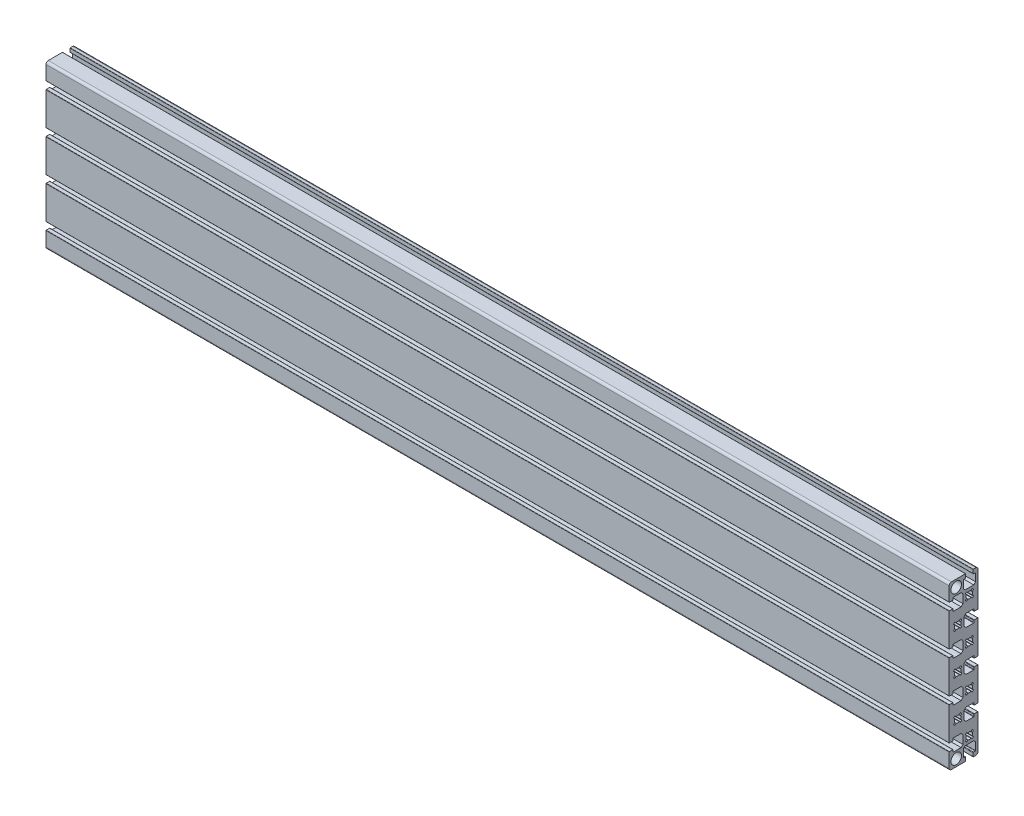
SolidWorks part; units mm, degrees
ref_plane "Front Plane" through (0, 0, 0) normal (0, 0, 1) x (1, 0, 0)
ref_plane "Top Plane" through (0, 0, 0) normal (0, 1, 0) x (1, 0, 0)
ref_plane "Right Plane" through (0, 0, 0) normal (1, 0, 0) x (0, 0, -1)
sketch "Sketch1" plane through (0, 0, 0) normal (0, 0, 1) x (1, 0, 0)
  line L0 (0, 0) -> (1000, 0)
  dimension "D1" = 1000
other "45-sarja 1.0051 32X180(1)"
ref_plane "Plane1" through (0, 0, 0) normal (1, 0, 0) x (0, 0, -1)
sketch "Model11" plane through (0, 0, 0) normal (1, 0, 0) x (0, 0, -1)
  line L0 (10.4902, 71.3785) -> (9.5003, 72.3684)
  line L1 (9.076, 72.3684) -> (8.0552, 71.3477)
  line L2 (4.1571, 71.3477) -> (3.1363, 72.3684)
  line L3 (2.712, 72.3684) -> (1.7221, 71.3785)
  line L4 (1.7221, 70.9542) -> (2.7429, 69.9335)
  line L5 (2.7429, 66.0353) -> (1.7221, 65.0145)
  line L6 (1.7221, 64.5903) -> (2.712, 63.6003)
  line L7 (3.1363, 63.6003) -> (4.1571, 64.6211)
  line L8 (8.0552, 64.6211) -> (9.076, 63.6003)
  line L9 (9.5003, 63.6003) -> (10.4902, 64.5903)
  line L10 (10.4902, 65.0145) -> (9.4694, 66.0353)
  line L11 (9.4694, 69.9335) -> (10.4902, 70.9542)
  line L12 (15.6061, 49.8844) -> (15.6061, 87.9844)
  line L13 (11.6061, 49.5844) -> (15.3061, 49.5844)
  line L14 (11.1061, 51.9844) -> (11.1061, 50.0844)
  line L15 (2.3061, 52.2844) -> (10.8061, 52.2844)
  line L16 (0.3061, 50.2844) -> (2.3061, 52.2844)
  line L17 (0.3061, 40.6844) -> (0.3061, 50.2844)
  line L18 (2.3061, 38.6844) -> (0.3061, 40.6844)
  line L19 (10.8061, 38.6844) -> (2.3061, 38.6844)
  line L20 (11.1061, 40.8844) -> (11.1061, 38.9844)
  line L21 (15.3061, 41.3844) -> (11.6061, 41.3844)
  line L22 (15.6061, 4.8844) -> (15.6061, 41.0844)
  line L23 (11.6061, 4.5844) -> (15.3061, 4.5844)
  line L24 (11.1061, 6.9844) -> (11.1061, 5.0844)
  line L25 (2.3061, 7.2844) -> (10.8061, 7.2844)
  line L26 (0.3061, 5.2844) -> (2.3061, 7.2844)
  line L27 (0.3061, -4.3156) -> (0.3061, 5.2844)
  line L28 (2.3061, -6.3156) -> (0.3061, -4.3156)
  line L29 (10.8061, -6.3156) -> (2.3061, -6.3156)
  line L30 (11.1061, -4.1156) -> (11.1061, -6.0156)
  line L31 (15.3061, -3.6156) -> (11.6061, -3.6156)
  line L32 (15.6061, -40.1156) -> (15.6061, -3.9156)
  line L33 (11.6061, -40.4156) -> (15.3061, -40.4156)
  line L34 (11.1061, -38.0156) -> (11.1061, -39.9156)
  line L35 (2.3061, -37.7156) -> (10.8061, -37.7156)
  line L36 (0.3061, -39.7156) -> (2.3061, -37.7156)
  line L37 (0.3061, -49.3156) -> (0.3061, -39.7156)
  line L38 (2.3061, -51.3156) -> (0.3061, -49.3156)
  line L39 (10.8061, -51.3156) -> (2.3061, -51.3156)
  line L40 (11.1061, -49.1156) -> (11.1061, -51.0156)
  line L41 (15.3061, -48.6156) -> (11.6061, -48.6156)
  line L42 (15.6061, -87.0156) -> (15.6061, -48.9156)
  line L43 (10.5061, -89.5156) -> (13.1061, -89.5156)
  line L44 (10.2061, -85.5156) -> (10.2061, -89.2156)
  line L45 (12.6061, -85.0156) -> (10.7061, -85.0156)
  line L46 (12.9061, -76.2156) -> (12.9061, -84.7156)
  line L47 (10.9061, -74.2156) -> (12.9061, -76.2156)
  line L48 (1.3061, -74.2156) -> (10.9061, -74.2156)
  line L49 (-0.6939, -76.2156) -> (1.3061, -74.2156)
  line L50 (-0.6939, -84.7156) -> (-0.6939, -76.2156)
  line L51 (1.5061, -85.0156) -> (-0.3939, -85.0156)
  line L52 (2.0061, -89.2156) -> (2.0061, -85.5156)
  line L53 (-13.8939, -89.5156) -> (1.7061, -89.5156)
  line L54 (-16.3939, -71.4156) -> (-16.3939, -87.0156)
  line L55 (-12.3939, -71.1156) -> (-16.0939, -71.1156)
  line L56 (-11.8939, -73.5156) -> (-11.8939, -71.6156)
  line L57 (-3.0939, -73.8156) -> (-11.5939, -73.8156)
  line L58 (-1.0939, -71.8156) -> (-3.0939, -73.8156)
  line L59 (-1.0939, -62.2156) -> (-1.0939, -71.8156)
  line L60 (-3.0939, -60.2156) -> (-1.0939, -62.2156)
  line L61 (-11.5939, -60.2156) -> (-3.0939, -60.2156)
  line L62 (-11.8939, -62.4156) -> (-11.8939, -60.5156)
  line L63 (-16.0939, -62.9156) -> (-12.3939, -62.9156)
  line L64 (-16.3939, -26.4156) -> (-16.3939, -62.6156)
  line L65 (-12.3939, -26.1156) -> (-16.0939, -26.1156)
  line L66 (-11.8939, -28.5156) -> (-11.8939, -26.6156)
  line L67 (-3.0939, -28.8156) -> (-11.5939, -28.8156)
  line L68 (-1.0939, -26.8156) -> (-3.0939, -28.8156)
  line L69 (-1.0939, -17.2156) -> (-1.0939, -26.8156)
  line L70 (-3.0939, -15.2156) -> (-1.0939, -17.2156)
  line L71 (-11.5939, -15.2156) -> (-3.0939, -15.2156)
  line L72 (-11.8939, -17.4156) -> (-11.8939, -15.5156)
  line L73 (-16.0939, -17.9156) -> (-12.3939, -17.9156)
  line L74 (-16.3939, 18.5844) -> (-16.3939, -17.6156)
  line L75 (-12.3939, 18.8844) -> (-16.0939, 18.8844)
  line L76 (-11.8939, 16.4844) -> (-11.8939, 18.3844)
  line L77 (-3.0939, 16.1844) -> (-11.5939, 16.1844)
  line L78 (-1.0939, 18.1844) -> (-3.0939, 16.1844)
  line L79 (-1.0939, 27.7844) -> (-1.0939, 18.1844)
  line L80 (-3.0939, 29.7844) -> (-1.0939, 27.7844)
  line L81 (-11.5939, 29.7844) -> (-3.0939, 29.7844)
  line L82 (-11.8939, 27.5844) -> (-11.8939, 29.4844)
  line L83 (-16.0939, 27.0844) -> (-12.3939, 27.0844)
  line L84 (-16.3939, 63.5844) -> (-16.3939, 27.3844)
  line L85 (-12.3939, 63.8844) -> (-16.0939, 63.8844)
  line L86 (-11.8939, 61.4844) -> (-11.8939, 63.3844)
  line L87 (-3.0939, 61.1844) -> (-11.5939, 61.1844)
  line L88 (-1.0939, 63.1844) -> (-3.0939, 61.1844)
  line L89 (-1.0939, 72.7844) -> (-1.0939, 63.1844)
  line L90 (-3.0939, 74.7844) -> (-1.0939, 72.7844)
  line L91 (-11.5939, 74.7844) -> (-3.0939, 74.7844)
  line L92 (-11.8939, 72.5844) -> (-11.8939, 74.4844)
  line L93 (-16.0939, 72.0844) -> (-12.3939, 72.0844)
  line L94 (-16.3939, 87.9844) -> (-16.3939, 72.3844)
  line L95 (1.7061, 90.4844) -> (-13.8939, 90.4844)
  line L96 (2.0061, 86.4844) -> (2.0061, 90.1844)
  line L97 (-0.3939, 85.9844) -> (1.5061, 85.9844)
  line L98 (-0.6939, 77.1844) -> (-0.6939, 85.6844)
  line L99 (1.3061, 75.1844) -> (-0.6939, 77.1844)
  line L100 (10.9061, 75.1844) -> (1.3061, 75.1844)
  line L101 (12.9061, 77.1844) -> (10.9061, 75.1844)
  line L102 (12.9061, 85.6844) -> (12.9061, 77.1844)
  line L103 (10.7061, 85.9844) -> (12.6061, 85.9844)
  line L104 (10.2061, 90.1844) -> (10.2061, 86.4844)
  line L105 (13.1061, 90.4844) -> (10.5061, 90.4844)
  line L106 (10.4902, -63.6215) -> (9.5003, -62.6316)
  line L107 (9.076, -62.6316) -> (8.0552, -63.6523)
  line L108 (4.1571, -63.6523) -> (3.1363, -62.6316)
  line L109 (2.712, -62.6316) -> (1.7221, -63.6215)
  line L110 (1.7221, -64.0458) -> (2.7429, -65.0665)
  line L111 (2.7429, -68.9647) -> (1.7221, -69.9855)
  line L112 (1.7221, -70.4097) -> (2.712, -71.3997)
  line L113 (3.1363, -71.3997) -> (4.1571, -70.3789)
  line L114 (8.0552, -70.3789) -> (9.076, -71.3997)
  line L115 (9.5003, -71.3997) -> (10.4902, -70.4097)
  line L116 (10.4902, -69.9855) -> (9.4694, -68.9647)
  line L117 (9.4694, -65.0665) -> (10.4902, -64.0458)
  line L118 (-2.5098, -41.1215) -> (-3.4997, -40.1316)
  line L119 (-3.924, -40.1316) -> (-4.9448, -41.1523)
  line L120 (-8.8429, -41.1523) -> (-9.8637, -40.1316)
  line L121 (-10.288, -40.1316) -> (-11.2779, -41.1215)
  line L122 (-11.2779, -41.5458) -> (-10.2571, -42.5665)
  line L123 (-10.2571, -46.4647) -> (-11.2779, -47.4855)
  line L124 (-11.2779, -47.9097) -> (-10.288, -48.8997)
  line L125 (-9.8637, -48.8997) -> (-8.8429, -47.8789)
  line L126 (-4.9448, -47.8789) -> (-3.924, -48.8997)
  line L127 (-3.4997, -48.8997) -> (-2.5098, -47.9097)
  line L128 (-2.5098, -47.4855) -> (-3.5306, -46.4647)
  line L129 (-3.5306, -42.5665) -> (-2.5098, -41.5458)
  line L130 (10.4902, -18.6215) -> (9.5003, -17.6316)
  line L131 (9.076, -17.6316) -> (8.0552, -18.6523)
  line L132 (4.1571, -18.6523) -> (3.1363, -17.6316)
  line L133 (2.712, -17.6316) -> (1.7221, -18.6215)
  line L134 (1.7221, -19.0458) -> (2.7429, -20.0665)
  line L135 (2.7429, -23.9647) -> (1.7221, -24.9855)
  line L136 (1.7221, -25.4097) -> (2.712, -26.3997)
  line L137 (3.1363, -26.3997) -> (4.1571, -25.3789)
  line L138 (8.0552, -25.3789) -> (9.076, -26.3997)
  line L139 (9.5003, -26.3997) -> (10.4902, -25.4097)
  line L140 (10.4902, -24.9855) -> (9.4694, -23.9647)
  line L141 (9.4694, -20.0665) -> (10.4902, -19.0458)
  line L142 (-2.5098, 3.8785) -> (-3.4997, 4.8684)
  line L143 (-3.924, 4.8684) -> (-4.9448, 3.8477)
  line L144 (-8.8429, 3.8477) -> (-9.8637, 4.8684)
  line L145 (-10.288, 4.8684) -> (-11.2779, 3.8785)
  line L146 (-11.2779, 3.4542) -> (-10.2571, 2.4335)
  line L147 (-10.2571, -1.4647) -> (-11.2779, -2.4855)
  line L148 (-11.2779, -2.9097) -> (-10.288, -3.8997)
  line L149 (-9.8637, -3.8997) -> (-8.8429, -2.8789)
  line L150 (-4.9448, -2.8789) -> (-3.924, -3.8997)
  line L151 (-3.4997, -3.8997) -> (-2.5098, -2.9097)
  line L152 (-2.5098, -2.4855) -> (-3.5306, -1.4647)
  line L153 (-3.5306, 2.4335) -> (-2.5098, 3.4542)
  line L154 (10.4902, 26.3785) -> (9.5003, 27.3684)
  line L155 (9.076, 27.3684) -> (8.0552, 26.3477)
  line L156 (4.1571, 26.3477) -> (3.1363, 27.3684)
  line L157 (2.712, 27.3684) -> (1.7221, 26.3785)
  line L158 (1.7221, 25.9542) -> (2.7429, 24.9335)
  line L159 (2.7429, 21.0353) -> (1.7221, 20.0145)
  line L160 (1.7221, 19.5903) -> (2.712, 18.6003)
  line L161 (3.1363, 18.6003) -> (4.1571, 19.6211)
  line L162 (8.0552, 19.6211) -> (9.076, 18.6003)
  line L163 (9.5003, 18.6003) -> (10.4902, 19.5903)
  line L164 (10.4902, 20.0145) -> (9.4694, 21.0353)
  line L165 (9.4694, 24.9335) -> (10.4902, 25.9542)
  line L166 (-2.5098, 48.8785) -> (-3.4997, 49.8684)
  line L167 (-3.924, 49.8684) -> (-4.9448, 48.8477)
  line L168 (-8.8429, 48.8477) -> (-9.8637, 49.8684)
  line L169 (-10.288, 49.8684) -> (-11.2779, 48.8785)
  line L170 (-11.2779, 48.4542) -> (-10.2572, 47.4335)
  line L171 (-10.2572, 43.5353) -> (-11.2779, 42.5145)
  line L172 (-11.2779, 42.0903) -> (-10.288, 41.1003)
  line L173 (-9.8637, 41.1003) -> (-8.8429, 42.1211)
  line L174 (-4.9448, 42.1211) -> (-3.924, 41.1003)
  line L175 (-3.4997, 41.1003) -> (-2.5098, 42.0903)
  line L176 (-2.5098, 42.5145) -> (-3.5306, 43.5353)
  line L177 (-3.5306, 47.4335) -> (-2.5098, 48.4542)
  arc A0 (10.4902, 70.9542) -> (10.4902, 71.3785) centre (10.2781, 71.1664) ccw
  arc A1 (9.5003, 72.3684) -> (9.076, 72.3684) centre (9.2881, 72.1563) ccw
  arc A2 (7.712, 71.29) -> (8.0552, 71.3477) centre (7.8431, 71.5598) ccw
  arc A3 (7.712, 71.29) -> (4.5003, 71.29) centre (6.1061, 67.9844) ccw
  arc A4 (4.1571, 71.3477) -> (4.5003, 71.29) centre (4.3692, 71.5598) ccw
  arc A5 (3.1363, 72.3684) -> (2.712, 72.3684) centre (2.9242, 72.1563) ccw
  arc A6 (1.7221, 71.3785) -> (1.7221, 70.9542) centre (1.9342, 71.1664) ccw
  arc A7 (2.8006, 69.5902) -> (2.7429, 69.9335) centre (2.5307, 69.7213) ccw
  arc A8 (2.8006, 69.5902) -> (2.8006, 66.3785) centre (6.1061, 67.9844) ccw
  arc A9 (2.7429, 66.0353) -> (2.8006, 66.3785) centre (2.5307, 66.2474) ccw
  arc A10 (1.7221, 65.0145) -> (1.7221, 64.5903) centre (1.9342, 64.8024) ccw
  arc A11 (2.712, 63.6003) -> (3.1363, 63.6003) centre (2.9242, 63.8125) ccw
  arc A12 (4.5003, 64.6788) -> (4.1571, 64.6211) centre (4.3692, 64.409) ccw
  arc A13 (4.5003, 64.6788) -> (7.712, 64.6788) centre (6.1061, 67.9844) ccw
  arc A14 (8.0552, 64.6211) -> (7.712, 64.6788) centre (7.8431, 64.409) ccw
  arc A15 (9.076, 63.6003) -> (9.5003, 63.6003) centre (9.2881, 63.8125) ccw
  arc A16 (10.4902, 64.5903) -> (10.4902, 65.0145) centre (10.2781, 64.8024) ccw
  arc A17 (9.4117, 66.3785) -> (9.4694, 66.0353) centre (9.6816, 66.2474) ccw
  arc A18 (9.4117, 66.3785) -> (9.4117, 69.5902) centre (6.1061, 67.9844) ccw
  arc A19 (9.4694, 69.9335) -> (9.4117, 69.5902) centre (9.6816, 69.7213) ccw
  circle A20 centre (-8.5439, 82.6344) radius 5.85
  arc A21 (15.3061, 49.5844) -> (15.6061, 49.8844) centre (15.3061, 49.8844) ccw
  arc A22 (11.1061, 50.0844) -> (11.6061, 49.5844) centre (11.6061, 50.0844) ccw
  arc A23 (11.1061, 51.9844) -> (10.8061, 52.2844) centre (10.8061, 51.9844) ccw
  arc A24 (10.8061, 38.6844) -> (11.1061, 38.9844) centre (10.8061, 38.9844) ccw
  arc A25 (11.6061, 41.3844) -> (11.1061, 40.8844) centre (11.6061, 40.8844) ccw
  arc A26 (15.6061, 41.0844) -> (15.3061, 41.3844) centre (15.3061, 41.0844) ccw
  arc A27 (15.3061, 4.5844) -> (15.6061, 4.8844) centre (15.3061, 4.8844) ccw
  arc A28 (11.1061, 5.0844) -> (11.6061, 4.5844) centre (11.6061, 5.0844) ccw
  arc A29 (11.1061, 6.9844) -> (10.8061, 7.2844) centre (10.8061, 6.9844) ccw
  arc A30 (10.8061, -6.3156) -> (11.1061, -6.0156) centre (10.8061, -6.0156) ccw
  arc A31 (11.6061, -3.6156) -> (11.1061, -4.1156) centre (11.6061, -4.1156) ccw
  arc A32 (15.6061, -3.9156) -> (15.3061, -3.6156) centre (15.3061, -3.9156) ccw
  arc A33 (15.3061, -40.4156) -> (15.6061, -40.1156) centre (15.3061, -40.1156) ccw
  arc A34 (11.1061, -39.9156) -> (11.6061, -40.4156) centre (11.6061, -39.9156) ccw
  arc A35 (11.1061, -38.0156) -> (10.8061, -37.7156) centre (10.8061, -38.0156) ccw
  arc A36 (10.8061, -51.3156) -> (11.1061, -51.0156) centre (10.8061, -51.0156) ccw
  arc A37 (11.6061, -48.6156) -> (11.1061, -49.1156) centre (11.6061, -49.1156) ccw
  arc A38 (15.6061, -48.9156) -> (15.3061, -48.6156) centre (15.3061, -48.9156) ccw
  arc A39 (13.1061, -89.5156) -> (15.6061, -87.0156) centre (13.1061, -87.0156) ccw
  arc A40 (10.2061, -89.2156) -> (10.5061, -89.5156) centre (10.5061, -89.2156) ccw
  arc A41 (10.7061, -85.0156) -> (10.2061, -85.5156) centre (10.7061, -85.5156) ccw
  arc A42 (12.6061, -85.0156) -> (12.9061, -84.7156) centre (12.6061, -84.7156) ccw
  arc A43 (-0.6939, -84.7156) -> (-0.3939, -85.0156) centre (-0.3939, -84.7156) ccw
  arc A44 (2.0061, -85.5156) -> (1.5061, -85.0156) centre (1.5061, -85.5156) ccw
  arc A45 (1.7061, -89.5156) -> (2.0061, -89.2156) centre (1.7061, -89.2156) ccw
  arc A46 (-16.3939, -87.0156) -> (-13.8939, -89.5156) centre (-13.8939, -87.0156) ccw
  arc A47 (-16.0939, -71.1156) -> (-16.3939, -71.4156) centre (-16.0939, -71.4156) ccw
  arc A48 (-11.8939, -71.6156) -> (-12.3939, -71.1156) centre (-12.3939, -71.6156) ccw
  arc A49 (-11.8939, -73.5156) -> (-11.5939, -73.8156) centre (-11.5939, -73.5156) ccw
  arc A50 (-11.5939, -60.2156) -> (-11.8939, -60.5156) centre (-11.5939, -60.5156) ccw
  arc A51 (-12.3939, -62.9156) -> (-11.8939, -62.4156) centre (-12.3939, -62.4156) ccw
  arc A52 (-16.3939, -62.6156) -> (-16.0939, -62.9156) centre (-16.0939, -62.6156) ccw
  arc A53 (-16.0939, -26.1156) -> (-16.3939, -26.4156) centre (-16.0939, -26.4156) ccw
  arc A54 (-11.8939, -26.6156) -> (-12.3939, -26.1156) centre (-12.3939, -26.6156) ccw
  arc A55 (-11.8939, -28.5156) -> (-11.5939, -28.8156) centre (-11.5939, -28.5156) ccw
  arc A56 (-11.5939, -15.2156) -> (-11.8939, -15.5156) centre (-11.5939, -15.5156) ccw
  arc A57 (-12.3939, -17.9156) -> (-11.8939, -17.4156) centre (-12.3939, -17.4156) ccw
  arc A58 (-16.3939, -17.6156) -> (-16.0939, -17.9156) centre (-16.0939, -17.6156) ccw
  arc A59 (-16.0939, 18.8844) -> (-16.3939, 18.5844) centre (-16.0939, 18.5844) ccw
  arc A60 (-11.8939, 18.3844) -> (-12.3939, 18.8844) centre (-12.3939, 18.3844) ccw
  arc A61 (-11.8939, 16.4844) -> (-11.5939, 16.1844) centre (-11.5939, 16.4844) ccw
  arc A62 (-11.5939, 29.7844) -> (-11.8939, 29.4844) centre (-11.5939, 29.4844) ccw
  arc A63 (-12.3939, 27.0844) -> (-11.8939, 27.5844) centre (-12.3939, 27.5844) ccw
  arc A64 (-16.3939, 27.3844) -> (-16.0939, 27.0844) centre (-16.0939, 27.3844) ccw
  arc A65 (-16.0939, 63.8844) -> (-16.3939, 63.5844) centre (-16.0939, 63.5844) ccw
  arc A66 (-11.8939, 63.3844) -> (-12.3939, 63.8844) centre (-12.3939, 63.3844) ccw
  arc A67 (-11.8939, 61.4844) -> (-11.5939, 61.1844) centre (-11.5939, 61.4844) ccw
  arc A68 (-11.5939, 74.7844) -> (-11.8939, 74.4844) centre (-11.5939, 74.4844) ccw
  arc A69 (-12.3939, 72.0844) -> (-11.8939, 72.5844) centre (-12.3939, 72.5844) ccw
  arc A70 (-16.3939, 72.3844) -> (-16.0939, 72.0844) centre (-16.0939, 72.3844) ccw
  arc A71 (-13.8939, 90.4844) -> (-16.3939, 87.9844) centre (-13.8939, 87.9844) ccw
  arc A72 (2.0061, 90.1844) -> (1.7061, 90.4844) centre (1.7061, 90.1844) ccw
  arc A73 (1.5061, 85.9844) -> (2.0061, 86.4844) centre (1.5061, 86.4844) ccw
  arc A74 (-0.3939, 85.9844) -> (-0.6939, 85.6844) centre (-0.3939, 85.6844) ccw
  arc A75 (12.9061, 85.6844) -> (12.6061, 85.9844) centre (12.6061, 85.6844) ccw
  arc A76 (10.2061, 86.4844) -> (10.7061, 85.9844) centre (10.7061, 86.4844) ccw
  arc A77 (10.5061, 90.4844) -> (10.2061, 90.1844) centre (10.5061, 90.1844) ccw
  arc A78 (15.6061, 87.9844) -> (13.1061, 90.4844) centre (13.1061, 87.9844) ccw
  circle A79 centre (-8.5439, -81.6656) radius 5.85
  arc A80 (10.4902, -64.0458) -> (10.4902, -63.6215) centre (10.2781, -63.8336) ccw
  arc A81 (9.5003, -62.6316) -> (9.076, -62.6316) centre (9.2881, -62.8437) ccw
  arc A82 (7.712, -63.71) -> (8.0552, -63.6523) centre (7.8431, -63.4402) ccw
  arc A83 (7.712, -63.71) -> (4.5003, -63.71) centre (6.1061, -67.0156) ccw
  arc A84 (4.1571, -63.6523) -> (4.5003, -63.71) centre (4.3692, -63.4402) ccw
  arc A85 (3.1363, -62.6316) -> (2.712, -62.6316) centre (2.9242, -62.8437) ccw
  arc A86 (1.7221, -63.6215) -> (1.7221, -64.0458) centre (1.9342, -63.8336) ccw
  arc A87 (2.8006, -65.4098) -> (2.7429, -65.0665) centre (2.5307, -65.2787) ccw
  arc A88 (2.8006, -65.4098) -> (2.8006, -68.6215) centre (6.1061, -67.0156) ccw
  arc A89 (2.7429, -68.9647) -> (2.8006, -68.6215) centre (2.5307, -68.7526) ccw
  arc A90 (1.7221, -69.9855) -> (1.7221, -70.4097) centre (1.9342, -70.1976) ccw
  arc A91 (2.712, -71.3997) -> (3.1363, -71.3997) centre (2.9242, -71.1875) ccw
  arc A92 (4.5003, -70.3212) -> (4.1571, -70.3789) centre (4.3692, -70.591) ccw
  arc A93 (4.5003, -70.3212) -> (7.712, -70.3212) centre (6.1061, -67.0156) ccw
  arc A94 (8.0552, -70.3789) -> (7.712, -70.3212) centre (7.8431, -70.591) ccw
  arc A95 (9.076, -71.3997) -> (9.5003, -71.3997) centre (9.2881, -71.1875) ccw
  arc A96 (10.4902, -70.4097) -> (10.4902, -69.9855) centre (10.2781, -70.1976) ccw
  arc A97 (9.4117, -68.6215) -> (9.4694, -68.9647) centre (9.6816, -68.7526) ccw
  arc A98 (9.4117, -68.6215) -> (9.4117, -65.4098) centre (6.1061, -67.0156) ccw
  arc A99 (9.4694, -65.0665) -> (9.4117, -65.4098) centre (9.6816, -65.2787) ccw
  arc A100 (-2.5098, -41.5458) -> (-2.5098, -41.1215) centre (-2.7219, -41.3336) ccw
  arc A101 (-3.4997, -40.1316) -> (-3.924, -40.1316) centre (-3.7119, -40.3437) ccw
  arc A102 (-5.288, -41.21) -> (-4.9448, -41.1523) centre (-5.1569, -40.9402) ccw
  arc A103 (-5.288, -41.21) -> (-8.4997, -41.21) centre (-6.8939, -44.5156) ccw
  arc A104 (-8.8429, -41.1523) -> (-8.4997, -41.21) centre (-8.6308, -40.9402) ccw
  arc A105 (-9.8637, -40.1316) -> (-10.288, -40.1316) centre (-10.0758, -40.3437) ccw
  arc A106 (-11.2779, -41.1215) -> (-11.2779, -41.5458) centre (-11.0658, -41.3336) ccw
  arc A107 (-10.1994, -42.9098) -> (-10.2571, -42.5665) centre (-10.4693, -42.7787) ccw
  arc A108 (-10.1994, -42.9098) -> (-10.1994, -46.1215) centre (-6.8939, -44.5156) ccw
  arc A109 (-10.2571, -46.4647) -> (-10.1994, -46.1215) centre (-10.4693, -46.2526) ccw
  arc A110 (-11.2779, -47.4855) -> (-11.2779, -47.9097) centre (-11.0658, -47.6976) ccw
  arc A111 (-10.288, -48.8997) -> (-9.8637, -48.8997) centre (-10.0758, -48.6875) ccw
  arc A112 (-8.4997, -47.8212) -> (-8.8429, -47.8789) centre (-8.6308, -48.091) ccw
  arc A113 (-8.4997, -47.8212) -> (-5.288, -47.8212) centre (-6.8939, -44.5156) ccw
  arc A114 (-4.9448, -47.8789) -> (-5.288, -47.8212) centre (-5.1569, -48.091) ccw
  arc A115 (-3.924, -48.8997) -> (-3.4997, -48.8997) centre (-3.7119, -48.6875) ccw
  arc A116 (-2.5098, -47.9097) -> (-2.5098, -47.4855) centre (-2.7219, -47.6976) ccw
  arc A117 (-3.5883, -46.1215) -> (-3.5306, -46.4647) centre (-3.3184, -46.2526) ccw
  arc A118 (-3.5883, -46.1215) -> (-3.5883, -42.9098) centre (-6.8939, -44.5156) ccw
  arc A119 (-3.5306, -42.5665) -> (-3.5883, -42.9098) centre (-3.3184, -42.7787) ccw
  arc A120 (10.4902, -19.0458) -> (10.4902, -18.6215) centre (10.2781, -18.8336) ccw
  arc A121 (9.5003, -17.6316) -> (9.076, -17.6316) centre (9.2881, -17.8437) ccw
  arc A122 (7.712, -18.71) -> (8.0552, -18.6523) centre (7.8431, -18.4402) ccw
  arc A123 (7.712, -18.71) -> (4.5003, -18.71) centre (6.1061, -22.0156) ccw
  arc A124 (4.1571, -18.6523) -> (4.5003, -18.71) centre (4.3692, -18.4402) ccw
  arc A125 (3.1363, -17.6316) -> (2.712, -17.6316) centre (2.9242, -17.8437) ccw
  arc A126 (1.7221, -18.6215) -> (1.7221, -19.0458) centre (1.9342, -18.8336) ccw
  arc A127 (2.8006, -20.4098) -> (2.7429, -20.0665) centre (2.5307, -20.2787) ccw
  arc A128 (2.8006, -20.4098) -> (2.8006, -23.6215) centre (6.1061, -22.0156) ccw
  arc A129 (2.7429, -23.9647) -> (2.8006, -23.6215) centre (2.5307, -23.7526) ccw
  arc A130 (1.7221, -24.9855) -> (1.7221, -25.4097) centre (1.9342, -25.1976) ccw
  arc A131 (2.712, -26.3997) -> (3.1363, -26.3997) centre (2.9242, -26.1875) ccw
  arc A132 (4.5003, -25.3212) -> (4.1571, -25.3789) centre (4.3692, -25.591) ccw
  arc A133 (4.5003, -25.3212) -> (7.712, -25.3212) centre (6.1061, -22.0156) ccw
  arc A134 (8.0552, -25.3789) -> (7.712, -25.3212) centre (7.8431, -25.591) ccw
  arc A135 (9.076, -26.3997) -> (9.5003, -26.3997) centre (9.2881, -26.1875) ccw
  arc A136 (10.4902, -25.4097) -> (10.4902, -24.9855) centre (10.2781, -25.1976) ccw
  arc A137 (9.4117, -23.6215) -> (9.4694, -23.9647) centre (9.6816, -23.7526) ccw
  arc A138 (9.4117, -23.6215) -> (9.4117, -20.4098) centre (6.1061, -22.0156) ccw
  arc A139 (9.4694, -20.0665) -> (9.4117, -20.4098) centre (9.6816, -20.2787) ccw
  arc A140 (-2.5098, 3.4542) -> (-2.5098, 3.8785) centre (-2.7219, 3.6664) ccw
  arc A141 (-3.4997, 4.8684) -> (-3.924, 4.8684) centre (-3.7119, 4.6563) ccw
  arc A142 (-5.288, 3.79) -> (-4.9448, 3.8477) centre (-5.1569, 4.0598) ccw
  arc A143 (-5.288, 3.79) -> (-8.4997, 3.79) centre (-6.8939, 0.4844) ccw
  arc A144 (-8.8429, 3.8477) -> (-8.4997, 3.79) centre (-8.6308, 4.0598) ccw
  arc A145 (-9.8637, 4.8684) -> (-10.288, 4.8684) centre (-10.0758, 4.6563) ccw
  arc A146 (-11.2779, 3.8785) -> (-11.2779, 3.4542) centre (-11.0658, 3.6664) ccw
  arc A147 (-10.1994, 2.0902) -> (-10.2571, 2.4335) centre (-10.4693, 2.2213) ccw
  arc A148 (-10.1994, 2.0902) -> (-10.1994, -1.1215) centre (-6.8939, 0.4844) ccw
  arc A149 (-10.2571, -1.4647) -> (-10.1994, -1.1215) centre (-10.4693, -1.2526) ccw
  arc A150 (-11.2779, -2.4855) -> (-11.2779, -2.9097) centre (-11.0658, -2.6976) ccw
  arc A151 (-10.288, -3.8997) -> (-9.8637, -3.8997) centre (-10.0758, -3.6875) ccw
  arc A152 (-8.4997, -2.8212) -> (-8.8429, -2.8789) centre (-8.6308, -3.091) ccw
  arc A153 (-8.4997, -2.8212) -> (-5.288, -2.8212) centre (-6.8939, 0.4844) ccw
  arc A154 (-4.9448, -2.8789) -> (-5.288, -2.8212) centre (-5.1569, -3.091) ccw
  arc A155 (-3.924, -3.8997) -> (-3.4997, -3.8997) centre (-3.7119, -3.6875) ccw
  arc A156 (-2.5098, -2.9097) -> (-2.5098, -2.4855) centre (-2.7219, -2.6976) ccw
  arc A157 (-3.5883, -1.1215) -> (-3.5306, -1.4647) centre (-3.3184, -1.2526) ccw
  arc A158 (-3.5883, -1.1215) -> (-3.5883, 2.0902) centre (-6.8939, 0.4844) ccw
  arc A159 (-3.5306, 2.4335) -> (-3.5883, 2.0902) centre (-3.3184, 2.2213) ccw
  arc A160 (10.4902, 25.9542) -> (10.4902, 26.3785) centre (10.2781, 26.1664) ccw
  arc A161 (9.5003, 27.3684) -> (9.076, 27.3684) centre (9.2881, 27.1563) ccw
  arc A162 (7.712, 26.29) -> (8.0552, 26.3477) centre (7.8431, 26.5598) ccw
  arc A163 (7.712, 26.29) -> (4.5003, 26.29) centre (6.1061, 22.9844) ccw
  arc A164 (4.1571, 26.3477) -> (4.5003, 26.29) centre (4.3692, 26.5598) ccw
  arc A165 (3.1363, 27.3684) -> (2.712, 27.3684) centre (2.9242, 27.1563) ccw
  arc A166 (1.7221, 26.3785) -> (1.7221, 25.9542) centre (1.9342, 26.1664) ccw
  arc A167 (2.8006, 24.5902) -> (2.7429, 24.9335) centre (2.5307, 24.7213) ccw
  arc A168 (2.8006, 24.5902) -> (2.8006, 21.3785) centre (6.1061, 22.9844) ccw
  arc A169 (2.7429, 21.0353) -> (2.8006, 21.3785) centre (2.5307, 21.2474) ccw
  arc A170 (1.7221, 20.0145) -> (1.7221, 19.5903) centre (1.9342, 19.8024) ccw
  arc A171 (2.712, 18.6003) -> (3.1363, 18.6003) centre (2.9242, 18.8125) ccw
  arc A172 (4.5003, 19.6788) -> (4.1571, 19.6211) centre (4.3692, 19.409) ccw
  arc A173 (4.5003, 19.6788) -> (7.712, 19.6788) centre (6.1061, 22.9844) ccw
  arc A174 (8.0552, 19.6211) -> (7.712, 19.6788) centre (7.8431, 19.409) ccw
  arc A175 (9.076, 18.6003) -> (9.5003, 18.6003) centre (9.2881, 18.8125) ccw
  arc A176 (10.4902, 19.5903) -> (10.4902, 20.0145) centre (10.2781, 19.8024) ccw
  arc A177 (9.4117, 21.3785) -> (9.4694, 21.0353) centre (9.6816, 21.2474) ccw
  arc A178 (9.4117, 21.3785) -> (9.4117, 24.5902) centre (6.1061, 22.9844) ccw
  arc A179 (9.4694, 24.9335) -> (9.4117, 24.5902) centre (9.6816, 24.7213) ccw
  arc A180 (-2.5098, 48.4542) -> (-2.5098, 48.8785) centre (-2.7219, 48.6664) ccw
  arc A181 (-3.4997, 49.8684) -> (-3.924, 49.8684) centre (-3.7119, 49.6563) ccw
  arc A182 (-5.288, 48.79) -> (-4.9448, 48.8477) centre (-5.1569, 49.0598) ccw
  arc A183 (-5.288, 48.79) -> (-8.4997, 48.79) centre (-6.8939, 45.4844) ccw
  arc A184 (-8.8429, 48.8477) -> (-8.4997, 48.79) centre (-8.6308, 49.0598) ccw
  arc A185 (-9.8637, 49.8684) -> (-10.288, 49.8684) centre (-10.0758, 49.6563) ccw
  arc A186 (-11.2779, 48.8785) -> (-11.2779, 48.4542) centre (-11.0658, 48.6664) ccw
  arc A187 (-10.1994, 47.0902) -> (-10.2572, 47.4335) centre (-10.4693, 47.2213) ccw
  arc A188 (-10.1994, 47.0902) -> (-10.1994, 43.8785) centre (-6.8939, 45.4844) ccw
  arc A189 (-10.2572, 43.5353) -> (-10.1994, 43.8785) centre (-10.4693, 43.7474) ccw
  arc A190 (-11.2779, 42.5145) -> (-11.2779, 42.0903) centre (-11.0658, 42.3024) ccw
  arc A191 (-10.288, 41.1003) -> (-9.8637, 41.1003) centre (-10.0758, 41.3125) ccw
  arc A192 (-8.4997, 42.1788) -> (-8.8429, 42.1211) centre (-8.6308, 41.909) ccw
  arc A193 (-8.4997, 42.1788) -> (-5.288, 42.1788) centre (-6.8939, 45.4844) ccw
  arc A194 (-4.9448, 42.1211) -> (-5.288, 42.1788) centre (-5.1569, 41.909) ccw
  arc A195 (-3.924, 41.1003) -> (-3.4997, 41.1003) centre (-3.7119, 41.3125) ccw
  arc A196 (-2.5098, 42.0903) -> (-2.5098, 42.5145) centre (-2.7219, 42.3024) ccw
  arc A197 (-3.5883, 43.8785) -> (-3.5306, 43.5353) centre (-3.3184, 43.7474) ccw
  arc A198 (-3.5883, 43.8785) -> (-3.5883, 47.0902) centre (-6.8939, 45.4844) ccw
  arc A199 (-3.5306, 47.4335) -> (-3.5883, 47.0902) centre (-3.3184, 47.2213) ccw
  point P557 (6.1061, 67.9844)
  point P558 (-6.8939, 45.4844)
  point P559 (-16.3939, 45.4844)
  point P560 (6.1061, 22.9844)
  point P561 (-16.3939, 0.4844)
  point P562 (-6.8939, 0.4844)
  point P563 (6.1061, -22.0156)
  point P564 (-6.8939, -44.5156)
  point P565 (6.1061, -67.0156)
  point P566 (-16.3939, 90.4844)
  point P567 (15.6061, 90.4844)
  point P568 (-16.3939, -89.5156)
  point P569 (15.6061, -89.5156)
  point P570 (15.6061, 0.4844)
  point P571 (0, 0)
